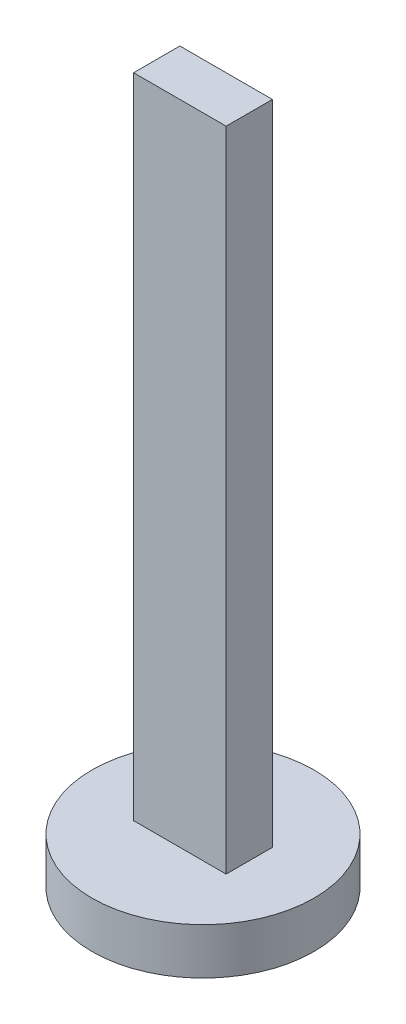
SolidWorks part; units mm, degrees
ref_plane "Front Plane" through (0, 0, 0) normal (0, 0, 1) x (1, 0, 0)
ref_plane "Top Plane" through (0, 0, 0) normal (0, 1, 0) x (1, 0, 0)
ref_plane "Right Plane" through (0, 0, 0) normal (1, 0, 0) x (0, 0, -1)
sketch "Sketch1" plane through (0, 0, 0) normal (0, 1, 0) x (1, 0, 0)
  circle A0 centre (0, 0) radius 12
  dimension "D1" = 24
extrude "Boss-Extrude1" add sketch "Sketch1" along normal blind 5
sketch "Sketch2" plane through (0, 0, 0) normal (0, -1, 0) x (1, 0, 0)
  circle A0 centre (0, 0) radius 10.5
  dimension "D1" = 21
extrude "Cut-Extrude1" cut sketch "Sketch2" against normal blind 2.5
sketch "Sketch3" plane through (0, 5, 0) normal (0, 1, 0) x (1, 0, 0)
  line L1 (-5, 2.5) -> (5, 2.5)
  line L2 (-5, 2.5) -> (-5, -2.5)
  line L3 (-5, -2.5) -> (5, -2.5)
  line L4 (5, 2.5) -> (5, -2.5)
  line L5 (-5, 2.5) -> (5, -2.5) construction
  line L6 (-5, -2.5) -> (5, 2.5) construction
  point P0 (0, 0)
  dimension "D1" = 10
  dimension "D2" = 5
extrude "Boss-Extrude2" add sketch "Sketch3" along normal blind 70
